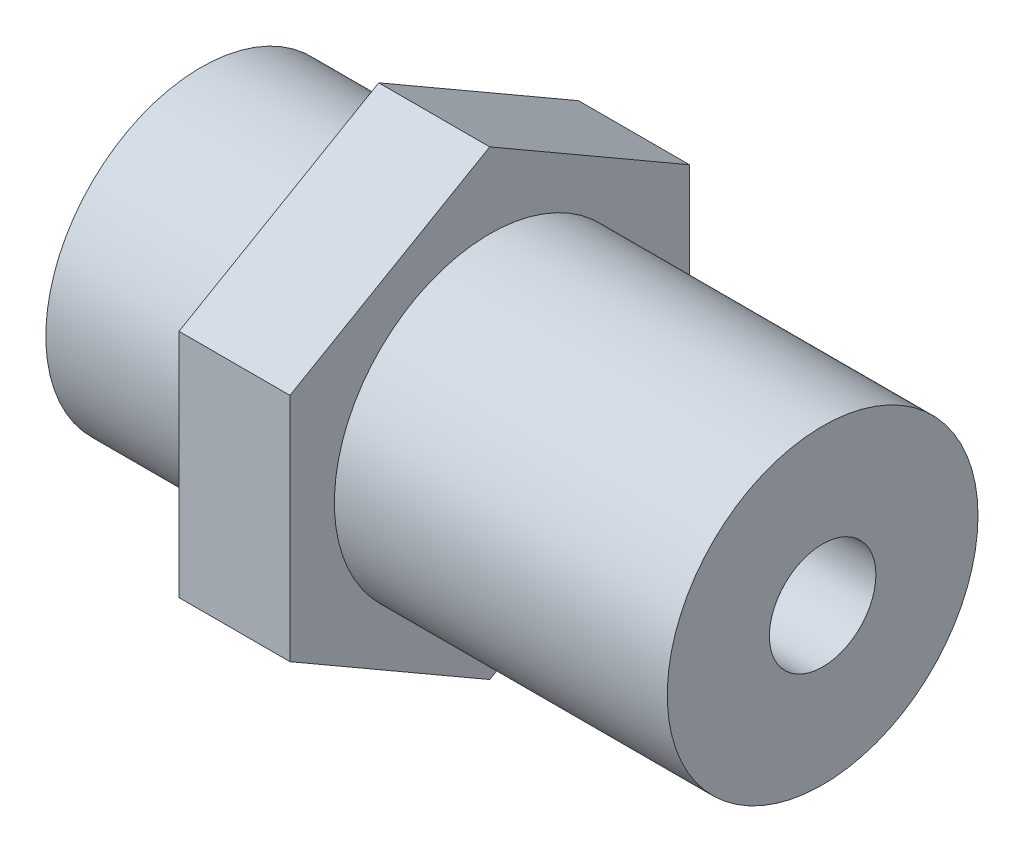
SolidWorks part; units mm, degrees
ref_plane "Alzado" through (0, 0, 0) normal (0, 0, 1) x (1, 0, 0)
ref_plane "Planta" through (0, 0, 0) normal (0, 1, 0) x (1, 0, 0)
ref_plane "Vista lateral" through (0, 0, 0) normal (1, 0, 0) x (0, 0, -1)
ref_plane "Plano2" through (-32, 0, 0) normal (1, 0, 0) x (0, 0, -1)
sketch "Sk_barril" plane through (-32, 0, 0) normal (1, 0, 0) x (0, 0, -1)
  circle A0 centre (-60.4, -16) radius 3.5
  circle A1 centre (-60.4, -16) radius 1.2
extrude "Barril" add sketch "Sk_barril" against normal blind 14 from offset 2
ref_plane "Plano4" through (-40, 0, 0) normal (1, 0, 0) x (0, 0, -1)
sketch "Sk_contratuerca" plane through (-40, 0, 0) normal (1, 0, 0) x (0, 0, -1)
  line L0 (-60.4, -10.8038) -> (-64.9, -13.4019)
  line L1 (-64.9, -13.4019) -> (-64.9, -18.5981)
  line L2 (-64.9, -18.5981) -> (-60.4, -21.1962)
  line L3 (-60.4, -21.1962) -> (-55.9, -18.5981)
  line L4 (-55.9, -18.5981) -> (-55.9, -13.4019)
  line L5 (-55.9, -13.4019) -> (-60.4, -10.8038)
  circle A0 centre (-60.4, -16) radius 1.2
extrude "Contratuerca" add sketch "Sk_contratuerca" along normal blind 2.5
